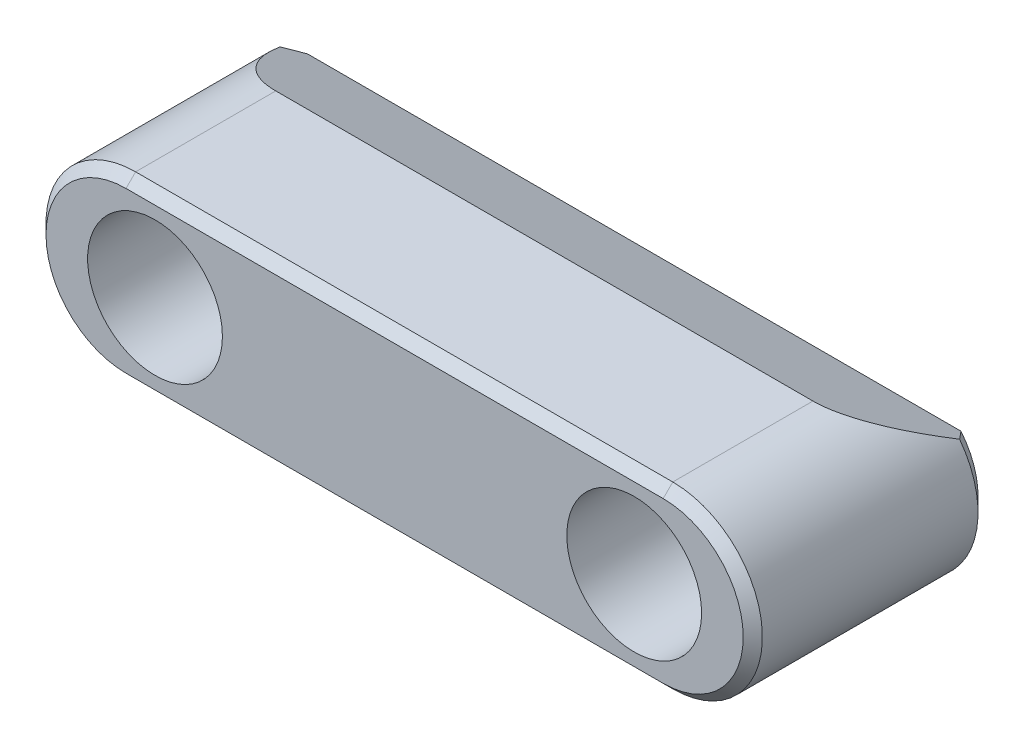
SolidWorks part; units mm, degrees
ref_plane "Front Plane" through (0, 0, 0) normal (0, 0, 1) x (1, 0, 0)
ref_plane "Top Plane" through (0, 0, 0) normal (0, 1, 0) x (1, 0, 0)
ref_plane "Right Plane" through (0, 0, 0) normal (1, 0, 0) x (0, 0, -1)
sketch "Sketch2" plane through (0, 0, 0) normal (0, 0, 1) x (1, 0, 0)
  line L0 (-14.2367, 0) -> (14.2367, 0) construction
  line L1 (-14.2367, 4.7498) -> (14.2367, 4.7498)
  line L2 (-14.2367, -4.7498) -> (14.2367, -4.7498)
  arc A0 (-14.2367, 4.7498) -> (-14.2367, -4.7498) centre (-14.2367, 0) ccw
  arc A1 (14.2367, -4.7498) -> (14.2367, 4.7498) centre (14.2367, 0) ccw
  point P2 (0, 0)
  dimension "D2" = 37.973
  dimension "D1" = 9.4996
  dimension "D3" = 28.4734
extrude "Boss-Extrude2" add sketch "Sketch2" against normal blind 12.7
hole_wizard "CBORE for #6 Socket Head Cap Screw1" positions "Sketch5" profile "Sketch6" counterbore size "#6" standard "ANSI Inch"
sketch "Sketch5" plane through (0, 0, 0) normal (0, 0, 1) x (1, 0, 0)
  line L0 (-12.7, 0) -> (12.7, 0) construction
  point P0 (-12.7, 0)
  point P5 (12.7, 0)
  dimension "D1" = 25.4
sketch "Sketch6" plane through (-12.7, 0, 0) normal (1, 0, 0) x (0, -1, 0)
  line L0 (0, 0) -> (0, 12.7)
  line L1 (0, 12.7) -> (2.1526, 12.7)
  line L3 (2.1526, 12.7) -> (2.1526, 5.08)
  line L4 (2.1526, 5.08) -> (3.5725, 5.08)
  line L5 (3.5725, 5.08) -> (3.5725, 0)
  line L7 (3.5725, 0) -> (0, 0)
  line L11 (0, -6.35) -> (0, 107.95) construction
  dimension "Thru Hole Dia." = 4.3053
  dimension "Thru Hole Depth" = 12.7
  dimension "C'Bore Dia." = 7.145
  dimension "C'Bore Depth" = 5.08
sketch "Sketch9" plane through (0, 0, 0) normal (1, 0, 0) x (0, 0, -1)
  line L0 (12.7, 4.7498) -> (7.9375, 4.7498)
  line L1 (12.7, 4.7498) -> (0, 4.7498) construction
  line L2 (7.9375, 4.7498) -> (12.7, 2.529)
  line L3 (12.7, -4.7498) -> (12.7, 4.7498) construction
  line L4 (12.7, 2.529) -> (12.7, 4.7498)
  dimension "D1" = 25
  dimension "D2" = 4.7625
extrude "Cut-Extrude1" cut sketch "Sketch9" against normal through all both and the other way through all
chamfer "Chamfer1" distance 0.508 angle 45 4 edges at (0, -4.7498, 0) (18.9865, 0, 0) (-18.9865, 0, 0) (0, 4.7498, 0)
chamfer "Chamfer2" distance 0.762 angle 45 3 edges at (-18.3944, -2.2966, -12.7) (18.3944, -2.2966, -12.7) (0, -4.7498, -12.7)
